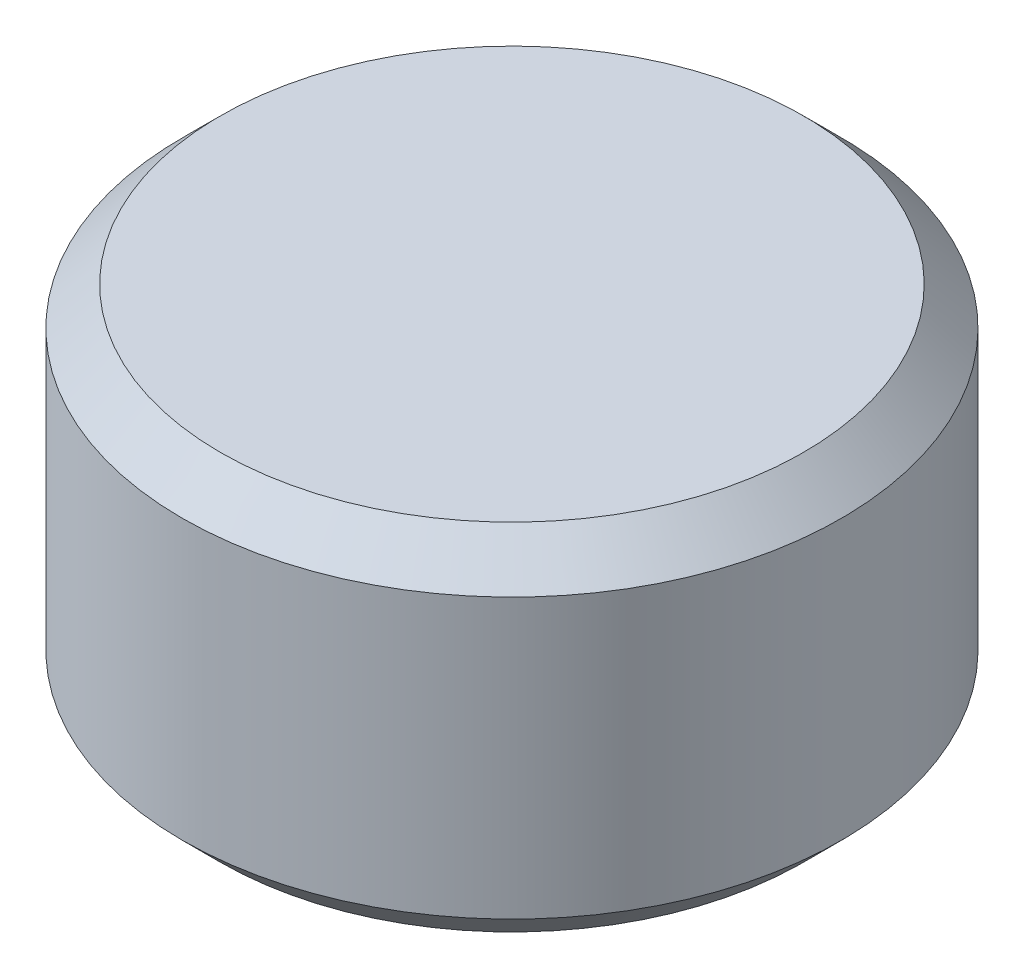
SolidWorks part; units mm, degrees
ref_plane "前视基准面" through (0, 0, 0) normal (0, 0, 1) x (1, 0, 0)
ref_plane "上视基准面" through (0, 0, 0) normal (0, 1, 0) x (1, 0, 0)
ref_plane "右视基准面" through (0, 0, 0) normal (1, 0, 0) x (0, 0, -1)
sketch "草图1" plane through (0, 0, 0) normal (0, 1, 0) x (1, 0, 0)
  circle A0 centre (0, 0) radius 13
  dimension "D1" = 26
extrude "凸台-拉伸1" add sketch "草图1" along normal blind 14
chamfer "倒角1" distance 1.5 angle 45 2 edges at (0, 0, 13) (0, 14, 13)
